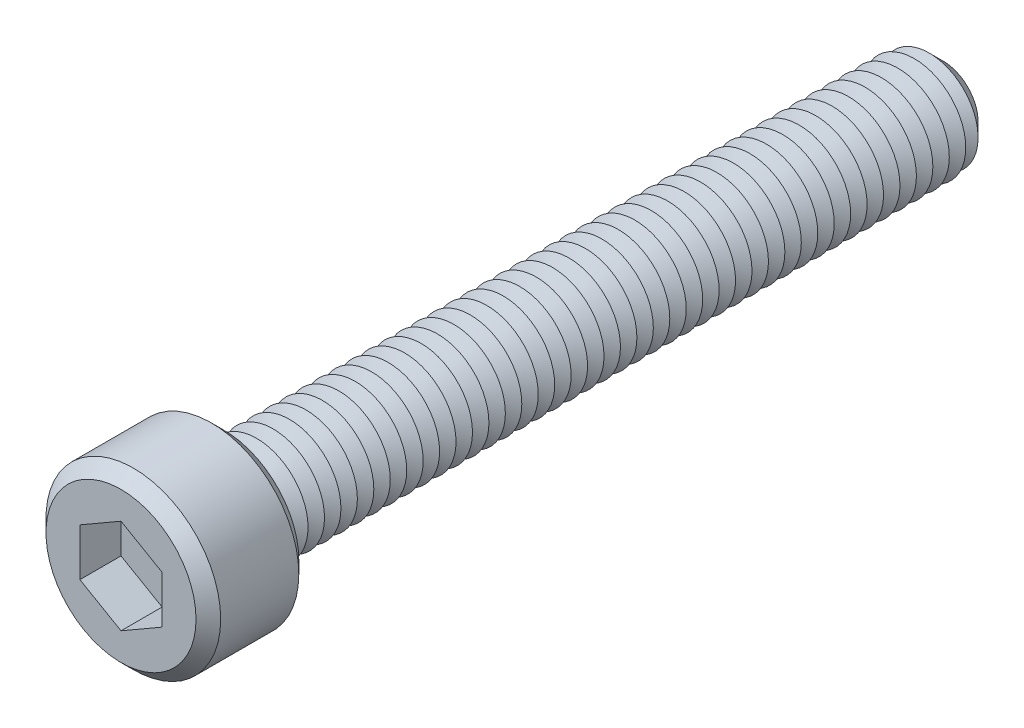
SolidWorks part; units mm, degrees
ref_plane "Front Plane" through (0, 0, 0) normal (0, 0, 1) x (1, 0, 0)
ref_plane "Top Plane" through (0, 0, 0) normal (0, 1, 0) x (1, 0, 0)
ref_plane "Right Plane" through (0, 0, 0) normal (1, 0, 0) x (0, 0, -1)
sketch "Sketch1" plane through (0, 0, 0) normal (0, 0, 1) x (1, 0, 0)
  circle A0 centre (0, 0) radius 4.25
  dimension "D1" = 8.5
extrude "Boss-Extrude1" add sketch "Sketch1" along normal blind 5
sketch "Sketch2" plane through (0, 0, 0) normal (0, 0, -1) x (-1, 0, 0)
  circle A0 centre (0, 0) radius 2.5
  dimension "D1" = 5
extrude "Boss-Extrude2" add sketch "Sketch2" along normal blind 35
chamfer "Chamfer1" distance 0.8 angle 45 1 edges at (-2.5, 0, -35)
sketch "Sketch3" plane through (0, 0, 0) normal (1, 0, 0) x (0, 0, -1)
  line L0 (-2.5121, 0) -> (4.5776, 0) construction
sketch "Sketch4" plane through (0, 0, 0) normal (1, 0, 0) x (0, 0, -1)
  line L0 (0, 2.5) -> (0.4, 1.8072)
  line L1 (0.4, 1.8072) -> (0.8, 2.5)
  line L2 (34.2, 2.5) -> (0, 2.5) construction
  line L3 (0.8, 2.5) -> (0, 2.5)
  dimension "D1" = 0.8
revolve "Cut-Revolve1" cut sketch "Sketch4" angle 360 about L0
pattern_linear "LPattern1" count 43 spacing 0.8 along (0, 0, -1) of "Cut-Revolve1"
sketch "Sketch5" plane through (0, 0, 5) normal (0, 0, 1) x (1, 0, 0)
  line L1 (0, 2.3094) -> (-2, 1.1547)
  line L2 (-2, 1.1547) -> (-2, -1.1547)
  line L3 (-2, -1.1547) -> (0, -2.3094)
  line L4 (0, -2.3094) -> (2, -1.1547)
  line L5 (2, -1.1547) -> (2, 1.1547)
  line L6 (2, 1.1547) -> (0, 2.3094)
  circle A0 centre (0, 0) radius 2 construction
  dimension "D1" = 4
extrude "Cut-Extrude1" cut sketch "Sketch5" against normal blind 2
sketch "Sketch6" plane through (0, 0, 3) normal (0, 0, 1) x (1, 0, 0)
  circle A0 centre (0, 0) radius 0.65
  dimension "D1" = 1.3
extrude "Cut-Extrude2" cut sketch "Sketch6" against normal up to surface (38 mm away)
chamfer "Chamfer2" distance 0.6 angle 45 2 edges at (4.25, 0, 0) (4.25, 0, 5)
